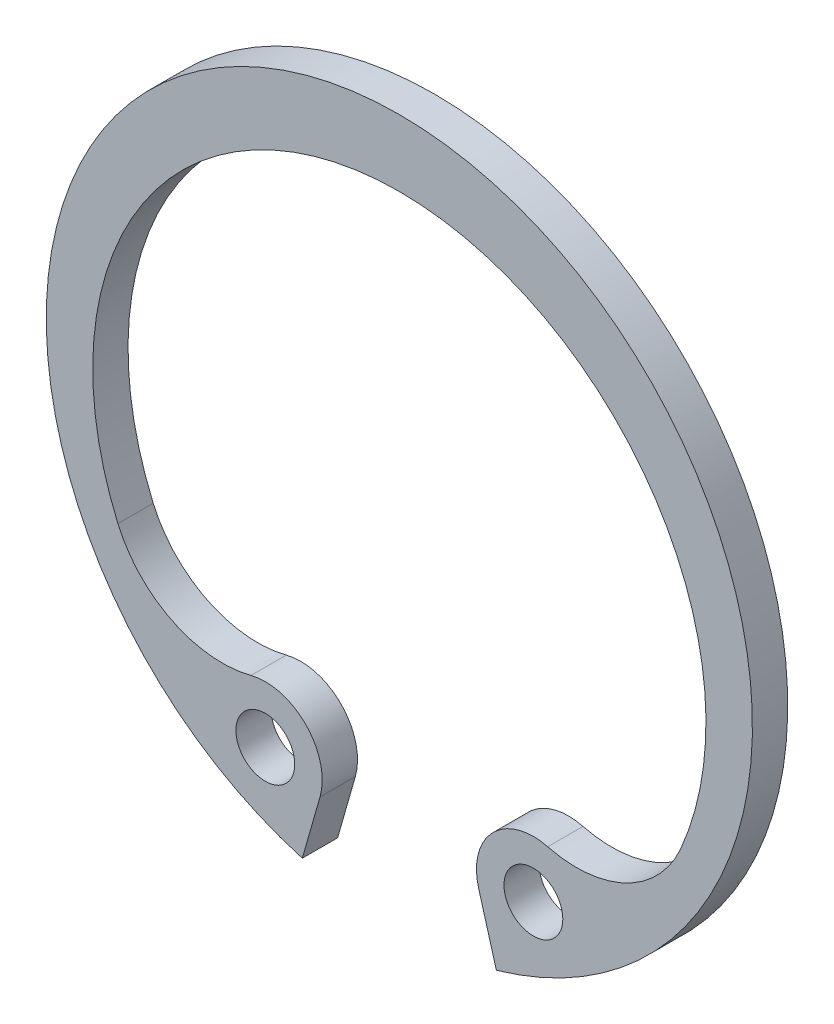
SolidWorks part; units mm, degrees
ref_plane "Plane1" through (0, 0, 0) normal (0, 0, 1) x (1, 0, 0)
ref_plane "Plane2" through (0, 0, 0) normal (0, 1, 0) x (1, 0, 0)
ref_plane "Plane3" through (0, 0, 0) normal (1, 0, 0) x (0, 0, -1)
extrude "Body" add sketch "BodySke" against normal blind 0.9
sketch "BodySke" plane through (0, 0, 0) normal (0, 0, 1) x (1, 0, 0)
  line L0 (-1.5431, 0) -> (1.5431, 0) construction
  line L1 (0, 0) -> (0, 7.3) construction
  line L2 (2.4732, -8.6535) -> (2.0221, -7.0752)
  line L3 (-2.4732, -8.6535) -> (-2.0221, -7.0752)
  line L4 (0, 0) -> (7.8967, -4.3177) construction
  line L5 (0, 0) -> (-7.8967, -4.3177) construction
  line L6 (-3.2102, -5.9556) -> (-3.6224, -7.3979) construction
  line L7 (3.21, -5.9551) -> (3.6225, -7.3984) construction
  arc A0 (-2.0221, -7.0752) -> (-3.7815, -5.2735) centre (-3.4163, -6.6768) ccw
  arc A1 (3.7815, -5.2735) -> (2.0221, -7.0752) centre (3.4163, -6.6768) ccw
  arc A2 (7.0631, -3.862) -> (-7.0631, -3.862) centre (0, -0.5157) ccw construction
  arc A3 (2.4732, -8.6535) -> (-2.4732, -8.6535) centre (0, 0) ccw
  circle A4 centre (3.4163, -6.6768) radius 0.75
  circle A5 centre (-3.4163, -6.6768) radius 0.75
  arc A7 (7.1736, -3.6181) -> (-7.1736, -3.6181) centre (0, -0.5157) ccw
  arc A8 (-3.4163, -6.6768) -> (3.4163, -6.6768) centre (0, 0) ccw construction
  arc A9 (-7.1736, -3.6181) -> (-3.7815, -5.2735) centre (-4.5118, -2.467) ccw
  arc A10 (3.7815, -5.2735) -> (7.1736, -3.6181) centre (4.5118, -2.467) ccw
  dimension "GrooveDia" = 18
  dimension "TipRad" = 1.45
  dimension "HoleOffsetRad" = 7.5
  dimension "HoleDia" = 1.5
  dimension "FilletRad" = 2.9
  dimension "LargeRad" = 7.3
  dimension "SmallRad" = 8.05
  dimension "SmallAngle" = 122.662
  dimension "GapAngle" = 31.9
sketch "Clipboard" plane through (0, 0, 0) normal (0, 0, 1) x (1, 0, 0)
  line L0 (0, 0) -> (1.7, 0)
  line L1 (0, 0) -> (0, 0.95)
  line L2 (0, 0) -> (0, -3.4)
  circle A0 centre (0, 0) radius 0.75
  circle A1 centre (0, 0) radius 8.5
  dimension "HoleDia" = 1.5
  dimension "BoreDia" = 17
  dimension "LargeSection" = 1.7
  dimension "SmallSection" = 0.95
  dimension "LugSection" = 3.4
sketch "ModLugSke" plane through (0, 0, 0) normal (0, 0, 1) x (1, 0, 0)
  line L0 (2.4732, -8.6535) -> (1.8572, -6.4983)
  line L1 (-2.4732, -8.6535) -> (-1.8572, -6.4983)
  line L2 (5.0863, -3.2759) -> (7.5664, -4.8733) construction
  line L3 (-5.0863, -3.2759) -> (-7.5664, -4.8733) construction
  line L4 (-2.4732, -8.6535) -> (-2.0221, -7.0752) construction
  line L5 (2.0221, -7.0752) -> (2.4732, -8.6535) construction
  line L6 (0, 0) -> (0, -12.7358) construction
  line L7 (6.7919, -4.3744) -> (7.5664, -4.8733)
  line L8 (-7.5664, -4.8733) -> (-6.7919, -4.3744)
  arc A0 (2.4732, -8.6535) -> (7.5664, -4.8733) centre (0, 0) ccw
  arc A1 (-3.3073, -5.066) -> (-2.294, -5.5982) centre (0, 0) ccw
  arc A2 (2.4732, -8.6535) -> (-2.4732, -8.6535) centre (0, 0) ccw construction
  arc A3 (3.7815, -5.2735) -> (2.0221, -7.0752) centre (3.4163, -6.6768) ccw construction
  arc A4 (-3.3073, -5.066) -> (-4.0868, -5.0413) centre (-3.7173, -5.694) ccw
  arc A5 (-6.7919, -4.3744) -> (-4.0868, -5.0413) centre (-5.0863, -3.2759) ccw
  arc A6 (7.1736, -3.6181) -> (-7.1736, -3.6181) centre (0, -0.5157) ccw construction
  arc A7 (4.0868, -5.0413) -> (6.7919, -4.3744) centre (5.0863, -3.2759) ccw
  arc A8 (2.294, -5.5982) -> (3.3073, -5.066) centre (0, 0) ccw
  arc A9 (-7.5664, -4.8733) -> (-2.4732, -8.6535) centre (0, 0) ccw
  circle A10 centre (-3.4163, -6.6768) radius 0.75
  circle A11 centre (-3.4163, -6.6768) radius 0.75 construction
  circle A12 centre (3.4163, -6.6768) radius 0.75
  circle A13 centre (3.4163, -6.6768) radius 0.75 construction
  arc A14 (-2.294, -5.5982) -> (-1.8572, -6.4983) centre (-2.5784, -6.2922) cw
  arc A15 (2.294, -5.5982) -> (1.8572, -6.4983) centre (2.5784, -6.2922) ccw
  arc A16 (3.3073, -5.066) -> (4.0868, -5.0413) centre (3.7173, -5.694) cw
  point P43 (1.6625, -5.8171)
  dimension "LugAng" = 66.277
extrude "ModLug" add sketch "ModLugSke" against normal through all
equation "' \"BoreDia@Clipboard\" = 8"
equation "' \"Thickness@Body\" = 0.4"
equation "' \"GrooveDia@BodySke\" = 8.4"
equation "' \"LugSection@Clipboard\" = 1.7"
equation "' \"LargeSection@Clipboard\" = 0.85"
equation "' \"SmallSection@Clipboard\" = 0.45"
equation "' \"HoleDia@Clipboard\" = 0.8"
equation "' \"BoreDia@Clipboard\" = 25"
equation "' \"Thickness@Body\" = 1.1"
equation "' \"GrooveDia@BodySke\" = 26.6"
equation "' \"LugSection@Clipboard\" = 4"
equation "' \"LargeSection@Clipboard\" = 2.6"
equation "' \"SmallSection@Clipboard\" = 1.3"
equation "' \"HoleDia@Clipboard\" = 1.5"
equation "\"TipRad@BodySke\" = (\"LugSection@Clipboard\" - (\"GrooveDia@BodySke\" / 2  -  \"BoreDia@Clipboard\" / 2 ) ) / 2"
equation "\"HoleOffsetRad@BodySke\" = (\"GrooveDia@BodySke\" / 2) - \"LugSection@Clipboard\"  + \"TipRad@BodySke\""
equation "\"LargeRad@BodySke\" =  \"GrooveDia@BodySke\" / 2 -  \"LargeSection@Clipboard\""
equation "\"SmallRad@BodySke\" =  \"GrooveDia@BodySke\" / 2 -  \"SmallSection@Clipboard\""
equation "\"HoleDia@BodySke\" =  \"HoleDia@Clipboard\""
equation "\"FilletRad@BodySke\" = \"TipRad@BodySke\" * 2"
equation "\"GapAngle@BodySke\" = 360 - 0.965 * 360 * ( \"BoreDia@Clipboard\" /  \"GrooveDia@BodySke\")"
equation "\"LugAng@ModLugSke\" = \"GapAngle@BodySke\"  + 1.5 * 360 * (\"LugSection@Clipboard\" / (\"BoreDia@Clipboard\" * 3.1416))"
